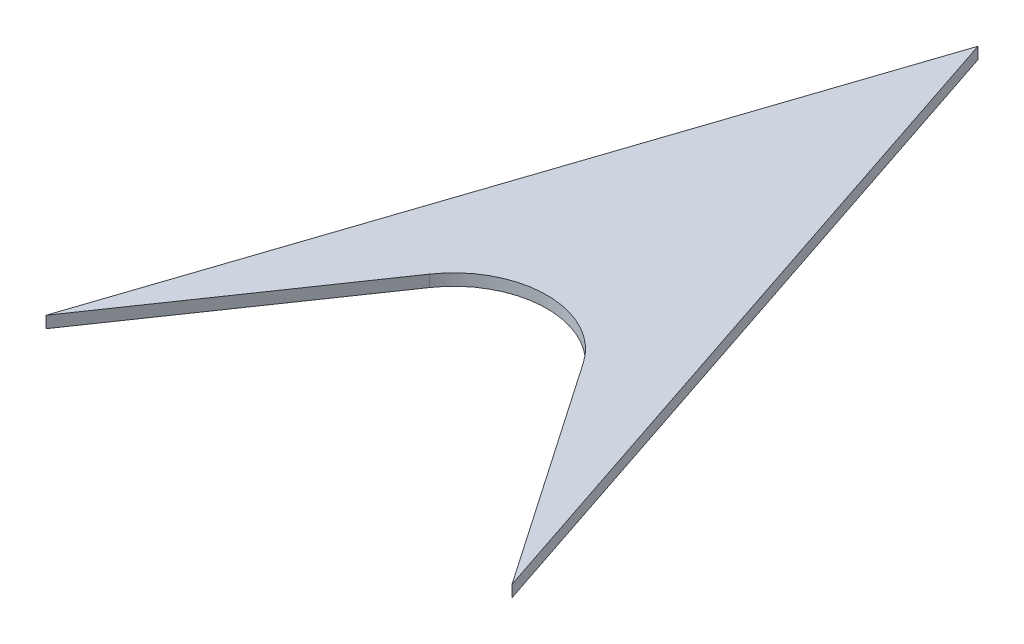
SolidWorks part; units mm, degrees
ref_plane "Front" through (0, 0, 0) normal (0, 0, 1) x (1, 0, 0)
ref_plane "Top" through (0, 0, 0) normal (0, 1, 0) x (1, 0, 0)
ref_plane "Right" through (0, 0, 0) normal (1, 0, 0) x (0, 0, -1)
sketch "Sketch1" plane through (0, 0, 0) normal (0, 1, 0) x (1, 0, 0)
  line L8 (20, -15) -> (0, 45)
  line L9 (0, 45) -> (-20, -15)
  line L10 (20, -15) -> (6.5954, 4.5274)
  line L11 (-20, -15) -> (-6.5954, 4.5274)
  arc A0 (6.5954, 4.5274) -> (-6.5954, 4.5274) centre (0, 0) ccw
extrude "Extrude1" add sketch "Sketch1" along normal blind 1
